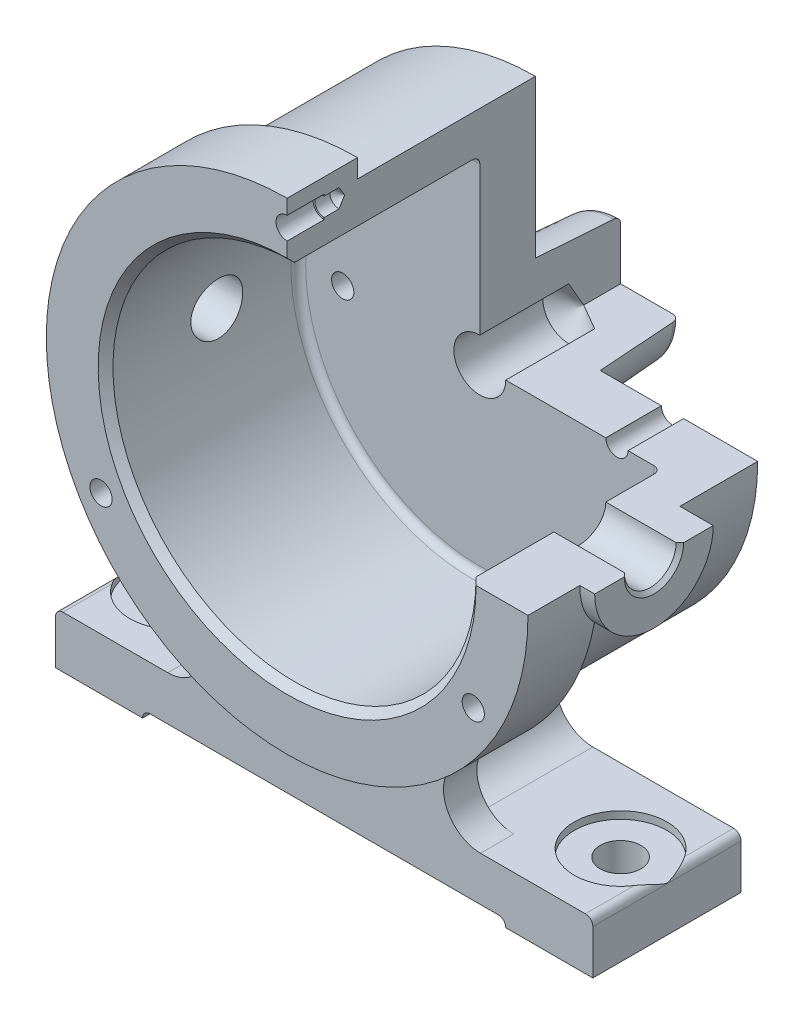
SolidWorks part; units mm, degrees
ref_plane "前视基准面" through (0, 0, 0) normal (0, 0, 1) x (1, 0, 0)
ref_plane "上视基准面" through (0, 0, 0) normal (0, 1, 0) x (1, 0, 0)
ref_plane "右视基准面" through (0, 0, 0) normal (1, 0, 0) x (0, 0, -1)
sketch "草图2" plane through (0, 0, 0) normal (1, 0, 0) x (0, 0, -1)
  line L0 (0, 0) -> (122.0368, 0) construction
  line L1 (30, -43.7566) -> (30, 84.7032) construction
  line L2 (0, 0) -> (0, 93.5348) construction
  line L3 (37, 60) -> (-11, 60)
  line L15 (-30, 65) -> (-30, 49)
  line L16 (-11, 65) -> (-30, 65)
  line L17 (-11, 60) -> (-11, 65)
  line L19 (37, 17.5) -> (37, 60)
  line L20 (60, 15.9116) -> (37, 17.5)
  line L21 (60, 0) -> (60, 15.9116)
  line L22 (46, 0) -> (60, 0)
  line L23 (46, 7) -> (46, 0)
  line L24 (22, 7) -> (46, 7)
  line L25 (22, 49) -> (22, 7)
  line L26 (-30, 49) -> (22, 49)
  point P8 (-37, 17.5)
  dimension "D1" = 30
revolve "旋转1" add sketch "草图2" angle 360 about L0
sketch "草图4" plane through (0, 0, 0) normal (0, 0, 1) x (1, 0, 0)
  line L0 (0, 0) -> (0, -139.3978) construction
  line L1 (49, -84) -> (-49, -84)
  line L2 (-49, -84) -> (-49, -86)
  line L3 (-49, -86) -> (-72.5, -86)
  line L4 (-72.5, -86) -> (-72.5, -72)
  line L5 (-72.5, -72) -> (-32.4962, -72)
  line L6 (72.5, -72) -> (32.4962, -72)
  line L7 (72.5, -86) -> (72.5, -72)
  line L8 (49, -86) -> (72.5, -86)
  line L9 (49, -84) -> (49, -86)
  arc A0 (-27.8538, -53.1429) -> (27.8538, -53.1429) centre (0, 0) ccw
  arc A1 (-32.4962, -72) -> (-27.8538, -53.1429) centre (-32.4962, -62) ccw
  arc A3 (32.4962, -72) -> (27.8538, -53.1429) centre (32.4962, -62) cw
  point P20 (0, -84)
  dimension "D3" = 120
  dimension "D4" = 20
  dimension "D1" = 84
  dimension "D2" = 72
extrude "拉伸1" add sketch "草图4" along normal mid plane 40
sketch "草图5" plane through (0, 0, 11) normal (0, 0, -1) x (-1, 0, 0)
  line L0 (72.5, -72) -> (72.5, -86)
  line L1 (72.5, -86) -> (49, -86)
  line L2 (49, -86) -> (49, -84)
  line L3 (49, -84) -> (-49, -84)
  line L4 (-49, -84) -> (-49, -86)
  line L5 (-49, -86) -> (-72.5, -86)
  line L6 (-72.5, -86) -> (-72.5, -72)
  line L7 (-72.5, -72) -> (-42.2019, -72)
  line L8 (-72.5, -72) -> (-32.4962, -72) construction
  line L9 (72.5, -72) -> (42.2019, -72)
  line L11 (0, 0) -> (0, -93.4808) construction
  arc A0 (-36.575, -53.7333) -> (36.575, -53.7333) centre (0, 0) ccw
  arc A1 (36.575, -53.7333) -> (42.2019, -72) centre (42.2019, -62) ccw
  arc A2 (-36.575, -53.7333) -> (-42.2019, -72) centre (-42.2019, -62) cw
  dimension "D1" = 130
  dimension "D2" = 20
extrude "拉伸2" add sketch "草图5" against normal up to surface (9 mm away)
ref_plane "基准面1" through (-69, 0, 0) normal (1, 0, 0) x (0, 0, -1)
sketch "草图7" plane through (-69, 0, 0) normal (1, 0, 0) x (0, 0, -1)
  circle A0 centre (0, 0) radius 16
extrude "拉伸3" add sketch "草图7" along normal up to next
mirror "镜向1" about plane through (0, 0, 0) normal (1, 0, 0) of "拉伸3"
sketch "草图8" plane through (0, -72, 0) normal (0, 1, 0) x (1, 0, 0)
  line L0 (-72.5, -20) -> (-72.5, 20) construction
  circle A0 centre (-59.99, 0) radius 12.5
  dimension "D1" = 12.51
extrude "切除-拉伸5" cut sketch "草图8" against normal blind 2
sketch "草图9" plane through (0, -74, 0) normal (0, 1, 0) x (1, 0, 0)
  circle A0 centre (-59.99, 0) radius 5.5
extrude "切除-拉伸6" cut sketch "草图9" against normal through all
mirror "镜向2" about plane through (0, 0, 0) normal (1, 0, 0) of "切除-拉伸6", "切除-拉伸5"
sketch "草图10" plane through (0, 0, -22) normal (0, 0, 1) x (1, 0, 0)
  line L0 (0, 0) -> (0, -29.3736) construction
  circle A0 centre (-37, 0) radius 3
  circle A1 centre (37, 0) radius 3
extrude "切除-拉伸7" cut sketch "草图10" against normal through all
sketch "草图11" plane through (0, 0, 0) normal (1, 0, 0) x (0, 0, -1)
  line L0 (0, 0) -> (83.2881, 0) construction
  line L1 (46, 7) -> (50.0415, 0)
  line L2 (46, 7) -> (46, -7) construction
  line L3 (50.0415, 0) -> (46, 0)
  line L4 (46, 0) -> (46, 7)
  dimension "D1" = 30
revolve "切除-旋转1" cut sketch "草图11" angle 360 about L3
fillet "圆角1" radius 2 1 edges at (49, 0, -22)
fillet "圆角2" radius 2 2 edges at (49, -84, 0) (-49, -84, 0)
fillet "圆角3" radius 2 2 edges at (72.5, -72, 0) (-72.5, -72, 0)
chamfer "倒角1" distance 2 angle 45 1 edges at (49, 0, 30)
sketch "草图12" plane through (-69, 0, 0) normal (-1, 0, 0) x (0, 0, 1)
  point P0 (0, 0)
hole_wizard "M16 螺纹孔1" positions "3D草图1" profile "草图13" tap size "M16" standard "ISO"
sketch3d "3D草图1"
  point P0 (-69, 0, 0)
sketch "草图13" plane through (-69, 0, 0) normal (0, 1, 0) x (0, 0, 1)
  line L0 (0, 0) -> (0, 141.5)
  line L1 (0, 141.5) -> (7, 141.5)
  line L2 (7, 141.5) -> (7, 0)
  line L5 (7, 0) -> (0, 0)
  line L11 (0, -6.35) -> (0, 107.95) construction
  dimension "籵謂蹟恇謂郰芛眻噤" = 14
  dimension "籵謂蹟恇謂郰芛旮僅" = 141.5
sketch "草图14" plane through (0, 0, 30) normal (0, 0, 1) x (1, 0, 0)
  line L0 (0, 0) -> (0, 13.1813) construction
  line L1 (0, 0) -> (14.4207, -8.3258) construction
  line L2 (0, 0) -> (-15.4049, -8.8941) construction
  point P6 (0, 58)
  point P7 (50.2295, -29)
  point P8 (-50.2295, -29)
  dimension "D1" = 120
  dimension "D2" = 120
hole_wizard "M6 螺纹孔1" positions "3D草图2" profile "草图15" tap size "M6" standard "ISO"
sketch3d "3D草图2"
  point P0 (0, 58, 30)
  point P3 (-50.2295, -29, 30)
  point P6 (50.2295, -29, 30)
sketch "草图15" plane through (0, 58, 30) normal (1, 0, 0) x (0, -1, 0)
  line L0 (0, 0) -> (0, 15.5022)
  line L1 (0, 15.5022) -> (2.5, 14)
  line L2 (2.5, 14) -> (2.5, 10)
  line L3 (2.5, 10) -> (3, 10)
  line L4 (3, 10) -> (3, 0)
  line L5 (3, 0) -> (0, 0)
  line L10 (0, 15.5022) -> (-2.5, 14) construction
  line L11 (0, -6.35) -> (0, 107.95) construction
  dimension "蹟恇謂郰芛眻噤" = 5
  dimension "蹟恇謂郰芛旮僅" = 14
  dimension "蹟恇翋眻噤" = 6
  dimension "蹟恇旮僅" = 10
  dimension "絳芛褒僅" = 118
fillet "圆角4" radius 2 1 edges at (15.9116, 0, -60)
chamfer "倒角2" distance 1 angle 45 1 edges at (-69, 0, 7)
chamfer "倒角3" distance 1 angle 45 1 edges at (69, 0, 7)
sketch "草图16" plane through (0, 0, 0) normal (0, 0, 1) x (1, 0, 0)
  line L1 (102.6002, 86.1509) -> (0, 86.1509)
  line L2 (102.6002, 86.1509) -> (102.6002, 0)
  line L3 (102.6002, 0) -> (0, 0)
  line L4 (0, 86.1509) -> (0, 0)
extrude "切除-拉伸8" cut sketch "草图16" against normal through all and the other way through all
sketch "草图17" plane through (0, 0, 0) normal (0, 1, 0) x (1, 0, 0)
  line L1 (0, 0) -> (118.751, 0)
  line L2 (0, 0) -> (0, -53.6021)
  line L3 (0, -53.6021) -> (118.751, -53.6021)
  line L4 (118.751, 0) -> (118.751, -53.6021)
extrude "切除-拉伸9" [suppressed] cut sketch "草图17" against normal through all and the other way through all
sketch "草图19" plane through (0, 0, 0) normal (1, 0, 0) x (0, 0, -1)
  line L0 (-52.6347, 74.4761) -> (-52.6347, -63.4995)
  line L3 (-52.6347, 74.4761) -> (102.0757, 74.4761)
  line L4 (102.0757, 74.4761) -> (99.0661, -84.6572)
  spline S2 degree 3 poles (-52.6347, -63.4995) (-49.0307, -59.3086) (-38.7204, -47.3193) (-9.7057, -67.5811) (38.5857, -42.626) (74.7657, -67.7695) (99.0661, -84.6572) knots 0 0 0 0 0.092682 0.265139 0.506429 1 1 1 1
extrude "切除-拉伸10" [suppressed] cut sketch "草图19" against normal blind 82
sketch "草图20" plane through (0, 0, 30) normal (0, 0, 1) x (1, 0, 0)
  line L1 (-92.9074, 78.3235) -> (83.3784, 78.3235)
  line L2 (-92.9074, 78.3235) -> (-92.9074, -66.3125)
  line L3 (-92.9074, -66.3125) -> (83.3784, -66.3125)
  line L4 (83.3784, 78.3235) -> (83.3784, -66.3125)
extrude "切除-拉伸11" [suppressed] cut sketch "草图20" against normal through all
